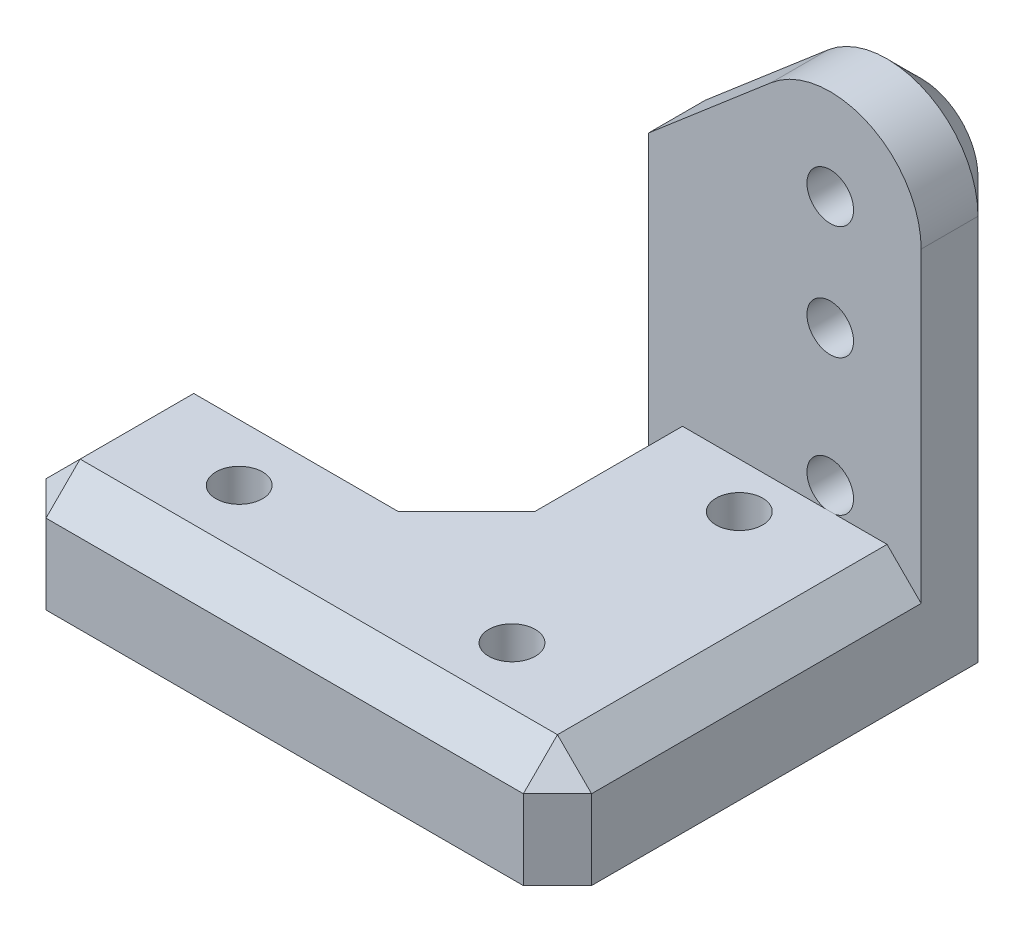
SolidWorks part; units mm, degrees
ref_plane "Plano frontal" through (0, 0, 0) normal (0, 0, 1) x (1, 0, 0)
ref_plane "Plano superior" through (0, 0, 0) normal (0, 1, 0) x (1, 0, 0)
ref_plane "Plano direito" through (0, 0, 0) normal (1, 0, 0) x (0, 0, -1)
sketch "Esboço1" plane through (0, 0, 0) normal (0, 0, 1) x (1, 0, 0)
  line L0 (0, 0) -> (0, 12)
  line L1 (0, 12) -> (9.4001, 20.0398)
  line L4 (16, 17) -> (16, 4)
  line L5 (16, 4) -> (16, 0)
  line L6 (16, 0) -> (0, 0)
  arc A0 (9.4001, 20.0398) -> (16, 17) centre (12, 17) cw
  point P19 (12, 17)
  dimension "D1" = 4
  dimension "D2" = 16
  dimension "D3" = 12
  dimension "D4" = 16
  dimension "D5" = 4
  dimension "D6" = 17
extrude "Ressalto-extrusão1" add sketch "Esboço1" along normal blind 20
sketch "Esboço2" plane through (0, 0, 0) normal (-1, 0, 0) x (0, 0, 1)
  line L0 (0, 0) -> (0, 5) construction
  line L1 (0, 5) -> (20, 5) construction
  line L3 (20, 21) -> (0, 21) construction
  line L4 (20, 5) -> (4, 5)
  line L5 (20, 5) -> (20, 21)
  line L6 (20, 21) -> (4, 21)
  line L7 (4, 5) -> (4, 21)
  dimension "D1" = 16
  dimension "D2" = 5
  dimension "D3" = 4
extrude "Corte-extrusão1" cut sketch "Esboço2" against normal through all
sketch "Esboço4" plane through (0, 0, 4) normal (0, 0, 1) x (1, 0, 0)
  point P0 (12, 17)
hole_wizard "Furo roscado de M2.51" positions "3DSketch1" profile "Esboço5" tap size "M2.5" standard "ISO"
sketch3d "3DSketch1"
  point P0 (12, 17, 4)
sketch "Esboço5" plane through (12, 17, 4) normal (1, 0, 0) x (0, -1, 0)
  line L0 (0, 0) -> (0, 7.8659)
  line L1 (0, 7.8659) -> (1.025, 7.25)
  line L2 (1.025, 7.25) -> (1.025, 0)
  line L5 (1.025, 0) -> (0, 0)
  line L10 (0, 7.8659) -> (-1.025, 7.25) construction
  line L11 (0, -6.35) -> (0, 107.95) construction
  dimension "Tap Drill Dia." = 2.05
  dimension "Tap Drill Depth" = 7.25
  dimension "Drill Angle" = 118
sketch "Esboço6" plane through (0, 0, 20) normal (0, 0, 1) x (1, 0, 0)
  line L0 (0, 0) -> (4, 0)
  line L1 (0, 0) -> (16, 0) construction
  line L2 (4, 0) -> (4, 15.4212)
  line L3 (0, 12) -> (9.4001, 20.0398) construction
  line L4 (4, 15.4212) -> (0, 12)
  line L5 (0, 12) -> (0, 0)
  dimension "D1" = 4
extrude "Corte-extrusão2" cut sketch "Esboço6" against normal through all
sketch "Esboço9" plane through (4, 0, 0) normal (-1, 0, 0) x (0, 0, 1)
  line L0 (20, 5) -> (12, 5)
  line L1 (4, 5) -> (20, 5) construction
  line L2 (12, 5) -> (12, 0)
  line L3 (0, 0) -> (20, 0) construction
  line L4 (12, 0) -> (20, 0)
  line L5 (20, 0) -> (20, 5)
  dimension "D1" = 8
extrude "Ressalto-extrusão2" add sketch "Esboço9" along normal blind 12
chamfer "Chanfro1" distance 1.5 angle 45 4 edges at (4, 7.7106, 0) (6.7, 17.7305, 0) (13.6734, 20.6332, 0) (16, 8.5, 0)
chamfer "Chanfro2" distance 1.5 angle 45 9 edges at (4, 2.5, 12) (-8, 2.5, 12) (-8, 2.5, 20) (16, 5, 12) (16, 2.5, 20) (4, 5, 20) (-8, 5, 16) (-2, 5, 12) (4, 5, 8)
sketch "Esboço10" plane through (0, 0, 0) normal (0, -1, 0) x (1, 0, 0)
  line L0 (-8, 16) -> (16, 16) construction
  line L1 (-8, 13.5) -> (-8, 18.5) construction
  line L2 (16, 18.5) -> (16, 1.5) construction
  line L3 (10, 0) -> (10, 16) construction
  line L4 (5.5, 0) -> (14.5, 0) construction
  line L5 (10, 16) -> (10, 20) construction
  line L6 (-6.5, 20) -> (14.5, 20) construction
  point P10 (10, 6)
  point P14 (10, 11)
  point P15 (-2, 16)
  point P16 (4, 16)
  dimension "D1" = 5
  dimension "D2" = 5
  dimension "D3" = 6
  dimension "D4" = 6
hole_wizard "Furo roscado de M2.52" positions "3DSketch2" profile "Esboço11" tap size "M2.5" standard "ISO"
sketch3d "3DSketch2"
  point P0 (10, 0, 6)
  point P6 (10, 0, 16)
  point P12 (-2, 0, 16)
sketch "Esboço11" plane through (10, 0, 6) normal (1, 0, 0) x (0, 0, -1)
  line L0 (0, 0) -> (0, 7.8659)
  line L1 (0, 7.8659) -> (1.025, 7.25)
  line L2 (1.025, 7.25) -> (1.025, 0)
  line L5 (1.025, 0) -> (0, 0)
  line L10 (0, 7.8659) -> (-1.025, 7.25) construction
  line L11 (0, -6.35) -> (0, 107.95) construction
  dimension "Tap Drill Dia." = 2.05
  dimension "Tap Drill Depth" = 7.25
  dimension "Drill Angle" = 118
sketch "Esboço12" plane through (0, 0, 0) normal (0, 0, -1) x (-1, 0, 0)
  line L0 (-16, 0) -> (-16, 17) construction
  line L1 (-5.5, 0) -> (-14.5, 0) construction
  line L2 (-12, 6) -> (-12, 12) construction
  point P0 (-12, 6)
  dimension "D1" = 4
  dimension "D2" = 6
  dimension "D3" = 6
hole_wizard "Broca de rosquear para tarraxa de M2.51" positions "3DSketch3" profile "Esboço13" hole size "M2.5" standard "ISO"
sketch3d "3DSketch3"
  point P0 (12, 6, 0)
  point P3 (12, 12, 0)
sketch "Esboço13" plane through (12, 6, 0) normal (1, 0, 0) x (0, 1, 0)
  line L0 (0, 0) -> (0, 4)
  line L1 (0, 4) -> (1.025, 4)
  line L2 (1.025, 4) -> (1.025, 0)
  line L5 (1.025, 0) -> (0, 0)
  line L11 (0, -6.35) -> (0, 107.95) construction
  dimension "Thru Hole Dia." = 2.05
  dimension "Thru Hole Depth" = 4
